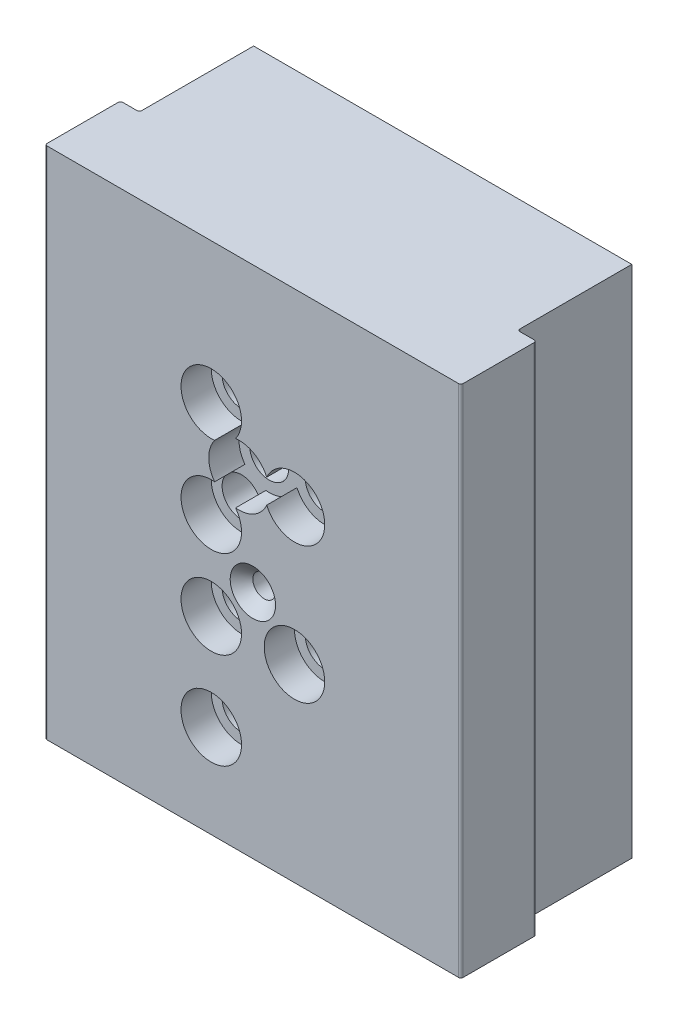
SolidWorks part; units mm, degrees
ref_plane "Plan de face" through (0, 0, 0) normal (0, 0, 1) x (1, 0, 0)
ref_plane "Plan de dessus" through (0, 0, 0) normal (0, 1, 0) x (1, 0, 0)
ref_plane "Plan de droite" through (0, 0, 0) normal (1, 0, 0) x (0, 0, -1)
sketch "Esquisse1" plane through (0, 0, 0) normal (0, 1, 0) x (1, 0, 0)
  line L0 (0, 0) -> (0, 25.1) construction
  line L1 (-25, 25.1) -> (25, 25.1)
  line L2 (-27.5, 10) -> (-27.5, 0)
  line L3 (-27.5, 0) -> (27.5, 0)
  line L4 (27.5, 10) -> (27.5, 0)
  line L8 (-27.5, 10) -> (-25, 10)
  line L9 (-25, 25.1) -> (-25, 10)
  line L12 (27.5, 10) -> (25, 10)
  line L13 (25, 25.1) -> (25, 10)
  dimension "D1" = 25.1
  dimension "D2" = 55
  dimension "D3" = 10
  dimension "D4" = 50
extrude "section profilé" add sketch "Esquisse1" along normal blind 68
fillet "Congé2" radius 0.3 6 edges at (-27.5, 34, 0) (-27.5, 34, -10) (-25, 34, -10) (27.5, 34, 0) (27.5, 34, -10) (25, 34, -10)
ref_plane "Plan pour buse" through (0, 0, -1.5) normal (0, 0, 1) x (1, 0, 0)
sketch "Esquisse2" plane through (0, 0, -1.5) normal (0, 0, 1) x (1, 0, 0)
  line L0 (0, 0) -> (0, 68) construction
  line L1 (25, 68) -> (-25, 68) construction
  circle A0 centre (0, 30.5) radius 1.5
  dimension "D1" = 30.5
  dimension "D2" = 3
extrude "carotte centrale" cut sketch "Esquisse2" against normal through all draft 2
sketch "Esquisse3" plane through (0, 0, -1.5) normal (0, 0, -1) x (-1, 0, 0)
  circle A1 centre (0, 30.5) radius 1.5
  circle A2 centre (0, 30.5) radius 1.5
  dimension "D1" = 0
extrude "cône d'appui buse centrale" cut sketch "Esquisse3" against normal blind 68 draft 45
sketch "Esquisse6" plane through (0, 0, 0) normal (0, 0, 1) x (1, 0, 0)
  circle A0 centre (-5.5, 49.3509) radius 2.5698 construction
  circle A1 centre (-5.5, 49.3509) radius 2.5698
  circle A2 centre (-1.8333, 43) radius 2.5698 construction
  circle A3 centre (-1.8333, 43) radius 2.5698
  circle A4 centre (5.5, 43) radius 2.5698 construction
  circle A5 centre (5.5, 43) radius 2.5698
  circle A6 centre (-5.5, 36.6491) radius 2.5698 construction
  circle A7 centre (-5.5, 36.6491) radius 2.5698
extrude "Enlèv. mat.-Extru.1" cut sketch "Esquisse6" against normal up to surface (50.2 mm away)
sketch "Esquisse7" plane through (0, 0, 0) normal (0, 0, 1) x (1, 0, 0)
  circle A0 centre (-5.5, 49.3509) radius 2.57
  circle A1 centre (-5.5, 36.6491) radius 2.57
  circle A2 centre (-1.8333, 43) radius 2.57
  circle A3 centre (5.5, 43) radius 2.57
  circle A4 centre (5.5, 43) radius 2.5698 construction
  circle A5 centre (-5.5, 49.3509) radius 2.5698 construction
  circle A6 centre (-5.5, 36.6491) radius 2.5698 construction
  circle A7 centre (-1.8333, 43) radius 2.5698 construction
  dimension "D1" = 5.14
extrude "Enlèv. mat.-Extru.2" cut sketch "Esquisse7" against normal through all
sketch "Esquisse8" plane through (0, 0, 0) normal (0, 0, 1) x (1, 0, 0)
  arc A0 (-2.2822, 46.9747) -> (-5.0511, 45.3761) centre (-5.5, 49.3509) ccw
  arc A1 (1.8333, 41.4014) -> (1.8333, 44.5986) centre (5.5, 43) ccw
  arc A2 (-5.0511, 40.6239) -> (-2.2822, 39.0253) centre (-5.5, 36.6491) ccw
  arc A3 (-5.0511, 45.3761) -> (-5.0511, 40.6239) centre (-1.8333, 43) ccw
  arc A4 (-2.2822, 39.0253) -> (1.8333, 41.4014) centre (-1.8333, 43) ccw
  arc A5 (1.8333, 44.5986) -> (-2.2822, 46.9747) centre (-1.8333, 43) ccw
  dimension "D1" = 8
extrude "Enlèv. mat.-Extru.3" cut sketch "Esquisse8" against normal blind 4
sketch "Esquisse9" plane through (0, 0, 0) normal (0, 0, 1) x (1, 0, 0)
  circle A0 centre (-5.5, 25) radius 2.5698 construction
  circle A1 centre (-5.5, 25) radius 2.5698
  circle A2 centre (-5.5, 12.3) radius 2.5698 construction
  circle A3 centre (-5.5, 12.3) radius 2.5698
  circle A4 centre (5.5, 25) radius 2.5698 construction
  circle A5 centre (5.5, 25) radius 2.5698
extrude "Enlèv. mat.-Extru.4" cut sketch "Esquisse9" against normal through all
sketch "Esquisse10" plane through (0, 0, 0) normal (0, 0, 1) x (1, 0, 0)
  circle A0 centre (-5.5, 25) radius 4
  circle A1 centre (-5.5, 12.3) radius 4
  circle A2 centre (5.5, 25) radius 4
  arc A3 (1.8333, 41.4014) -> (1.8333, 44.5986) centre (5.5, 43) ccw construction
extrude "Enlèv. mat.-Extru.5" cut sketch "Esquisse10" against normal up to surface (4 mm away)
sketch "Esquisse11" plane through (0, 0, -25.1) normal (0, 0, -1) x (-1, 0, 0)
  circle A0 centre (17.3, 60) radius 4 construction
  circle A1 centre (17.3, 60) radius 4
  circle A2 centre (-17.3, 8) radius 4 construction
  circle A3 centre (-17.3, 8) radius 4
extrude "Boss.-Extru.1" add sketch "Esquisse11" along normal blind 4 draft 5
chamfer "Chanfrein1" distance 0.5 angle 45 2 edges at (13.65, 8, -29.1) (-20.95, 60, -29.1)
